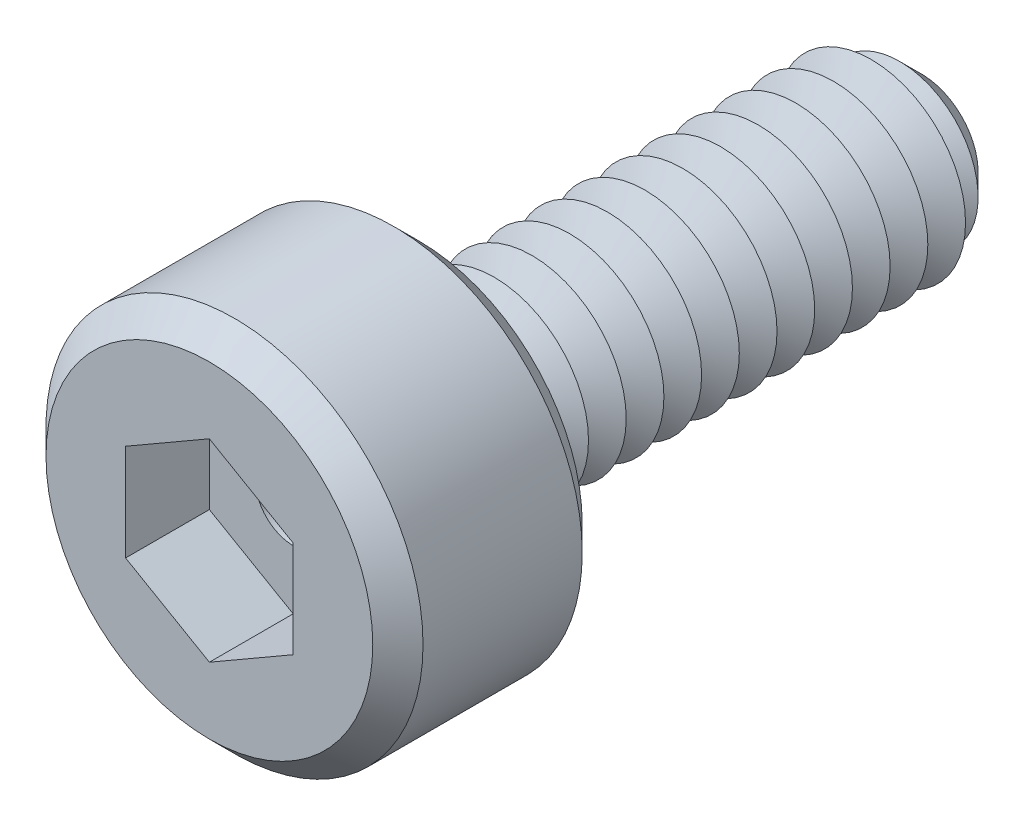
SolidWorks part; units mm, degrees
ref_plane "Front Plane" through (0, 0, 0) normal (0, 0, 1) x (1, 0, 0)
ref_plane "Top Plane" through (0, 0, 0) normal (0, 1, 0) x (1, 0, 0)
ref_plane "Right Plane" through (0, 0, 0) normal (1, 0, 0) x (0, 0, -1)
sketch "Sketch1" plane through (0, 0, 0) normal (0, 0, 1) x (1, 0, 0)
  circle A0 centre (0, 0) radius 2.25
  dimension "D1" = 4.5
extrude "Boss-Extrude1" add sketch "Sketch1" along normal blind 2.5
sketch "Sketch2" plane through (0, 0, 0) normal (0, 0, -1) x (-1, 0, 0)
  circle A0 centre (0, 0) radius 1.125
  dimension "D1" = 2.25
extrude "Boss-Extrude2" add sketch "Sketch2" along normal blind 6
chamfer "Chamfer1" distance 0.45 angle 45 1 edges at (-1.125, 0, -6)
sketch "Sketch3" plane through (0, 0, 0) normal (1, 0, 0) x (0, 0, -1)
  line L0 (-2.5121, 0) -> (4.5776, 0) construction
sketch "Sketch4" plane through (0, 0, 0) normal (1, 0, 0) x (0, 0, -1)
  line L0 (0, 1.125) -> (0.225, 0.7353)
  line L1 (0.225, 0.7353) -> (0.45, 1.125)
  line L2 (5.55, 1.125) -> (0, 1.125) construction
  line L3 (0.45, 1.125) -> (0, 1.125)
  dimension "D1" = 0.45
revolve "Cut-Revolve1" cut sketch "Sketch4" angle 360 about L0
pattern_linear "LPattern1" count 13 spacing 0.45 along (0, 0, -1) of "Cut-Revolve1"
sketch "Sketch5" plane through (0, 0, 2.5) normal (0, 0, 1) x (1, 0, 0)
  line L1 (0, 1.1547) -> (-1, 0.5774)
  line L2 (-1, 0.5774) -> (-1, -0.5774)
  line L3 (-1, -0.5774) -> (0, -1.1547)
  line L4 (0, -1.1547) -> (1, -0.5774)
  line L5 (1, -0.5774) -> (1, 0.5774)
  line L6 (1, 0.5774) -> (0, 1.1547)
  circle A0 centre (0, 0) radius 1 construction
  dimension "D1" = 2
extrude "Cut-Extrude1" cut sketch "Sketch5" against normal blind 1
sketch "Sketch6" plane through (0, 0, 1.5) normal (0, 0, 1) x (1, 0, 0)
  circle A0 centre (0, 0) radius 0.45
  dimension "D1" = 0.9
extrude "Cut-Extrude2" cut sketch "Sketch6" against normal up to surface (7.5 mm away)
chamfer "Chamfer2" distance 0.3 angle 45 2 edges at (2.25, 0, 0) (2.25, 0, 2.5)
